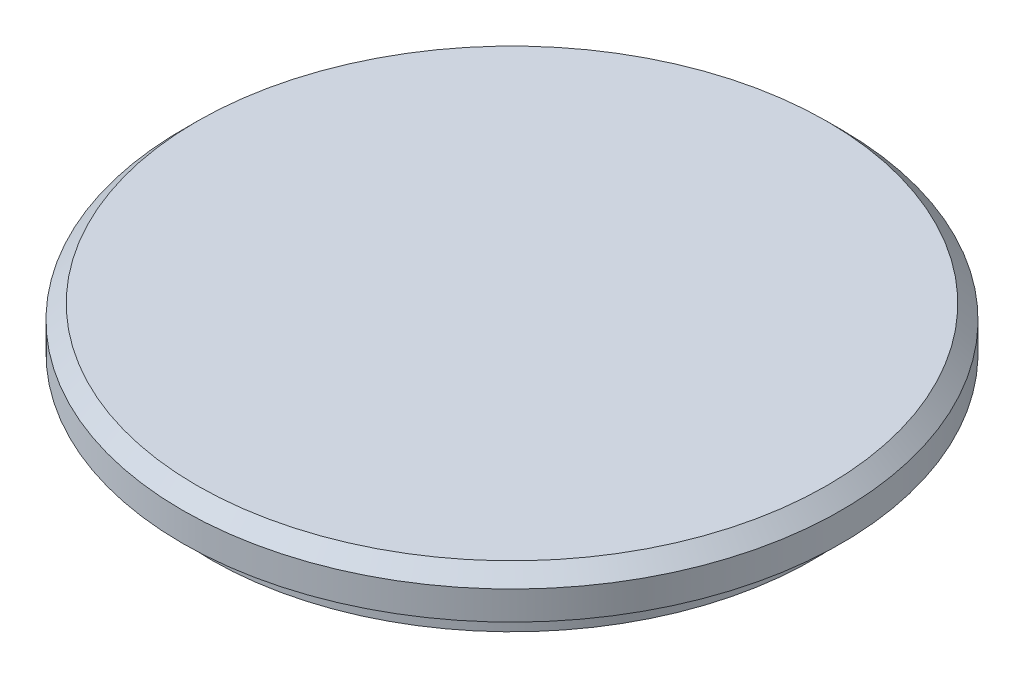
SolidWorks part; units mm, degrees
ref_plane "Plan1" through (0, 0, 0) normal (0, 0, 1) x (1, 0, 0)
ref_plane "Plan2" through (0, 0, 0) normal (0, 1, 0) x (1, 0, 0)
ref_plane "Plan3" through (0, 0, 0) normal (1, 0, 0) x (0, 0, -1)
sketch "Esquisse1" plane through (0, 0, 0) normal (0, 0, 1) x (1, 0, 0)
  line L0 (0, 60) -> (0, -30) construction
  line L1 (0, 12) -> (22, 12)
  line L2 (22, 12) -> (23, 11)
  line L3 (23, 11) -> (23, 9)
  line L4 (23, 9) -> (21, 9)
  line L5 (21, 9) -> (21, 7)
  line L6 (21, 7) -> (19, 7)
  line L7 (19, 7) -> (19, 9.5)
  line L8 (18.5, 10) -> (0, 10)
  line L9 (0, 10) -> (0, 12)
  arc A0 (19, 9.5) -> (18.5, 10) centre (18.5, 9.5) ccw
  point P14 (19, 10)
  dimension "D9" = 0.5
  dimension "D1" = 2
  dimension "D2" = 22
  dimension "D3" = 23
  dimension "D4" = 1
  dimension "D5" = 2
  dimension "D6" = 19
  dimension "D7" = 2
  dimension "D8" = 21
revolve "Base-Révolution" add sketch "Esquisse1" angle 360 about L0
